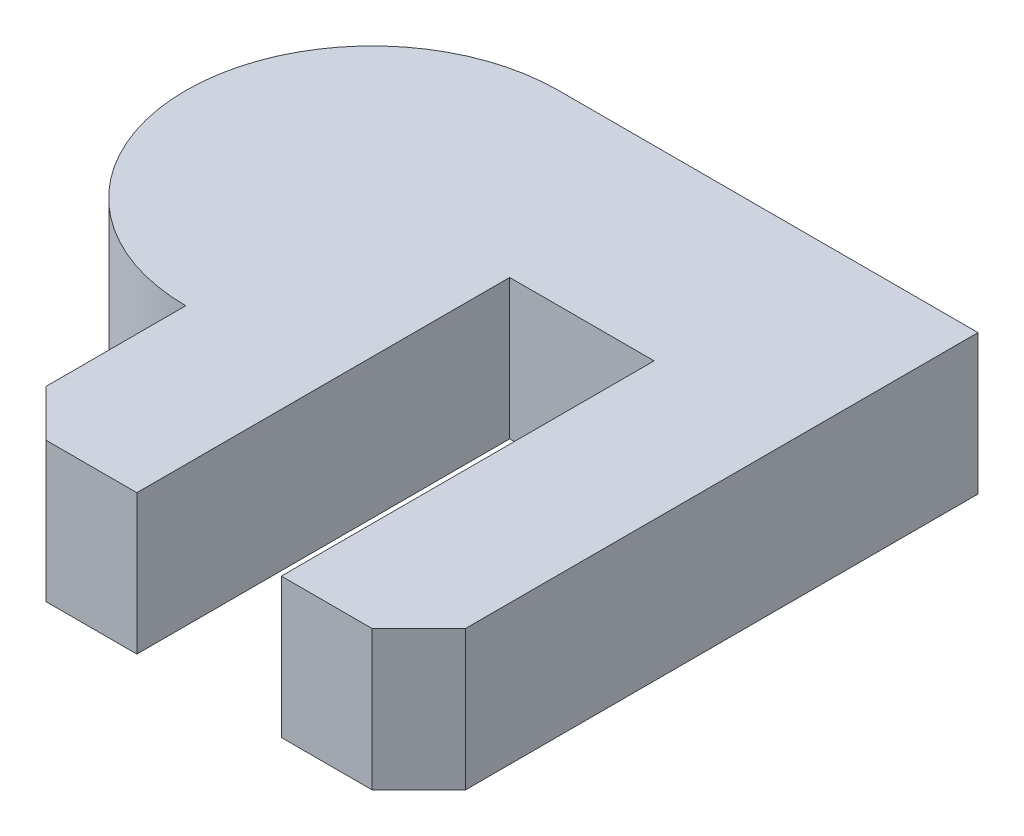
SolidWorks part; units mm, degrees
ref_plane "Front Plane" through (0, 0, 0) normal (0, 0, 1) x (1, 0, 0)
ref_plane "Top Plane" through (0, 0, 0) normal (0, 1, 0) x (1, 0, 0)
ref_plane "Right Plane" through (0, 0, 0) normal (1, 0, 0) x (0, 0, -1)
sketch "Sketch1" plane through (0, 0, 0) normal (0, 1, 0) x (1, 0, 0)
  line L1 (-4.5, -6) -> (4.5, -6)
  line L2 (-4.5, -6) -> (-4.5, 6)
  line L3 (-4.5, 6) -> (4.5, 6)
  line L4 (4.5, -6) -> (4.5, 6)
  line L5 (-4.5, -6) -> (4.5, 6) construction
  line L6 (-4.5, 6) -> (4.5, -6) construction
  point P0 (0, 0)
  dimension "D1" = 9
  dimension "D2" = 12
extrude "Boss-Extrude1" add sketch "Sketch1" along normal blind 3
sketch "Sketch2" plane through (0, 0, 0) normal (0, 1, 0) x (1, 0, 0)
  line L0 (0, 0) -> (0, -2) construction
  line L1 (-4.5, -6) -> (4.5, -6) construction
  line L3 (-1.55, 2) -> (1.55, 2)
  line L4 (-1.55, 2) -> (-1.55, -6)
  line L5 (-1.55, -6) -> (1.55, -6)
  line L6 (1.55, 2) -> (1.55, -6)
  line L7 (-1.55, 2) -> (1.55, -6) construction
  line L8 (-1.55, -6) -> (1.55, 2) construction
  dimension "D1" = 3.1
  dimension "D2" = 8
extrude "Cut-Extrude1" cut sketch "Sketch2" along normal blind 3
sketch "Sketch3" plane through (0, 0, 0) normal (0, 1, 0) x (1, 0, 0)
  line L0 (-4.5, 6) -> (-4.5, -6) construction
  line L1 (-4.5, 6) -> (-4.5, -2)
  arc A0 (-4.5, 6) -> (-4.5, -2) centre (-4.5, 2) ccw
  dimension "D1" = 8
extrude "Boss-Extrude2" add sketch "Sketch3" along normal blind 3
sketch "Sketch4" plane through (0, 0, 0) normal (0, 1, 0) x (1, 0, 0)
  line L0 (-4.5, -6) -> (-3.5, -6)
  line L1 (-4.5, -6) -> (-1.55, -6) construction
  line L2 (-3.5, -6) -> (-4.5, -5)
  line L3 (-4.5, -2) -> (-4.5, -6) construction
  line L4 (-4.5, -5) -> (-4.5, -6)
  line L5 (0, -0.097) -> (0, -1.1815) construction
  line L6 (4.5, -5) -> (4.5, -6)
  line L7 (3.5, -6) -> (4.5, -5)
  line L8 (4.5, -6) -> (3.5, -6)
  dimension "D1" = 1
extrude "Cut-Extrude2" cut sketch "Sketch4" along normal blind 10
